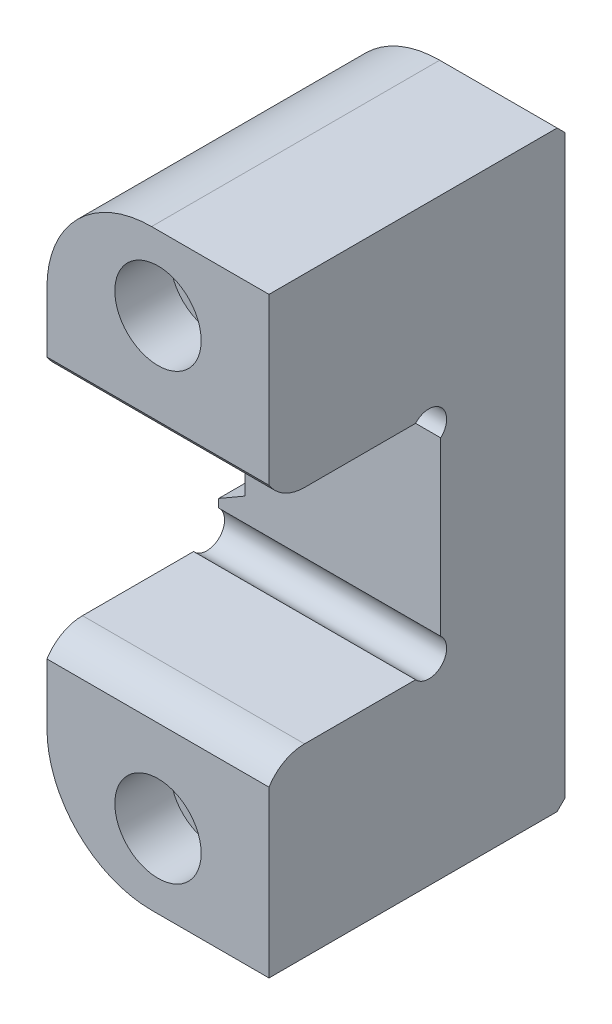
SolidWorks part; units mm, degrees
ref_plane "Front Plane" through (0, 0, 0) normal (0, 0, 1) x (1, 0, 0)
ref_plane "Top Plane" through (0, 0, 0) normal (0, 1, 0) x (1, 0, 0)
ref_plane "Right Plane" through (0, 0, 0) normal (1, 0, 0) x (0, 0, -1)
sketch "Sketch1" plane through (0, 0, 0) normal (1, 0, 0) x (0, 0, -1)
  line L0 (0, 0) -> (50000, 0) construction
  line L1 (0, 14.2875) -> (22.098, 14.2875)
  line L2 (0, 38.1) -> (38.1, 38.1)
  line L3 (0, 38.1) -> (0, 14.2875)
  line L4 (0, -38.1) -> (38.1, -38.1)
  line L5 (38.1, 38.1) -> (38.1, -38.1)
  line L6 (22.098, 14.2875) -> (22.098, -14.2875)
  line L7 (22.098, -14.2875) -> (0, -14.2875)
  line L9 (0, 15.7163) -> (0, -15.7163) construction
  line L10 (0, -14.2875) -> (0, -38.1)
  dimension "D1" = 38.1
  dimension "D2" = 76.2
  dimension "D3" = 22.098
  dimension "D4" = 28.575
extrude "Extrude1" add sketch "Sketch1" along normal mid plane 28.575
fillet "Fillet1" radius 13.462 2 edges at (-14.2875, -38.1, -19.05) (-14.2875, 38.1, -19.05)
sketch "Sketch2" plane through (-23.8125, 0, -38.1) normal (0, 0, 1) x (1, 0, 0)
  line L0 (0, 0) -> (50000, 0) construction
  line L1 (38.1, -38.1) -> (38.1, 38.1) construction
  line L2 (35.7187, 8.6085) -> (38.8937, 10.4415) construction
  line L3 (35.7187, 8.6085) -> (35.7187, -8.6085) construction
  line L4 (35.7187, -8.6085) -> (38.8937, -10.4415) construction
  line L5 (38.8937, 10.4415) -> (38.8937, -10.4415) construction
  line L6 (23.8125, 0) -> (23.8125, 50000) construction
  line L7 (8.7312, 10.4415) -> (8.7312, -10.4415)
  line L8 (11.9062, -8.6085) -> (8.7312, -10.4415)
  line L9 (11.9062, 8.6085) -> (11.9062, -8.6085)
  line L10 (11.9062, 8.6085) -> (8.7312, 10.4415)
  point P4 (37.3062, 9.525)
  point P10 (37.3062, -9.525)
  point P13 (10.3187, -9.525)
  point P14 (10.3187, 9.525)
  dimension "D1" = 19.05
  dimension "D2" = 2.3813
  dimension "D3" = 30
  dimension "D4" = 3.175
extrude "Cut-Extrude1" cut sketch "Sketch2" along normal through all
sketch "Sketch5" plane through (14.2875, 0, 0) normal (1, 0, 0) x (0, 0, -1)
  line L0 (0, 0) -> (50000, 0) construction
  line L1 (0, 14.2875) -> (22.098, 14.2875) construction
  line L2 (0, 38.1) -> (0, 14.2875) construction
  line L3 (0, -14.2875) -> (0, -38.1) construction
  line L4 (-1.778, -13.6525) -> (4.572, -13.6525)
  line L5 (-1.778, -13.6525) -> (-1.778, -16.8275)
  line L6 (-1.778, -16.8275) -> (0, -16.8275)
  line L7 (4.572, -13.6525) -> (4.572, -14.2875)
  line L8 (22.098, -14.2875) -> (0, -14.2875) construction
  line L9 (4.572, 13.6525) -> (4.572, 14.2875)
  line L10 (-1.778, 16.8275) -> (0, 16.8275)
  line L11 (-1.778, 13.6525) -> (-1.778, 16.8275)
  line L12 (-1.778, 13.6525) -> (4.572, 13.6525)
  arc A0 (1.7842, -14.5973) -> (4.572, -14.2875) centre (4.572, -26.9875) cw construction
  arc A1 (0, -16.8275) -> (1.7842, -14.5973) centre (2.286, -16.8275) cw construction
  arc A2 (0, 16.8275) -> (1.7842, 14.5973) centre (2.286, 16.8275) ccw construction
  arc A3 (1.7842, 14.5973) -> (4.572, 14.2875) centre (4.572, 26.9875) ccw construction
  arc A4 (0, 16.8275) -> (4.572, 14.2875) centre (4.572, 19.6723) ccw
  arc A5 (0, -16.8275) -> (4.572, -14.2875) centre (4.572, -19.6723) cw
  dimension "D1" = 2.286
  dimension "D2" = 12.7
  dimension "D3" = 3.175
  dimension "D4" = 6.35
  dimension "D5" = 4.572
extrude "Cut-Extrude2" cut sketch "Sketch5" against normal through all
sketch "Sketch6" plane through (14.2875, 0, 0) normal (1, 0, 0) x (0, 0, -1)
  line L0 (0, 0) -> (50000, 0) construction
  line L3 (22.098, 14.2875) -> (22.098, -14.2875) construction
  line L4 (4.572, 14.2875) -> (22.098, 14.2875) construction
  circle A0 centre (20.574, 12.7635) radius 2.286
  circle A1 centre (20.574, -12.7635) radius 2.286
  dimension "D2" = 0.762
  dimension "D3" = 2.286
  dimension "D1" = 0.762
extrude "Cut-Extrude3" cut sketch "Sketch6" against normal through all
hole_wizard "1/4\"-20 CBORE" positions "Sketch4" profile "Sketch3" counterbore size "1/4" standard "Ansi Inch"
sketch "Sketch4" plane through (0, 0, 0) normal (0, 0, 1) x (1, 0, 0)
  line L0 (0, 0) -> (0, 50000) construction
  line L1 (0, 0) -> (50000, 0) construction
  point P0 (0, 28.575)
  point P12 (0, -28.575)
  dimension "D1" = 57.15
sketch "Sketch3" plane through (0, 28.575, 0) normal (1, 0, 0) x (0, -1, 0)
  line L0 (0, 0) -> (0, 38.1)
  line L1 (0, 38.1) -> (3.5712, 38.1)
  line L3 (3.5712, 38.1) -> (3.5712, 7.1437)
  line L4 (3.5712, 7.1437) -> (5.5562, 7.1437)
  line L5 (5.5562, 7.1437) -> (5.5562, 0)
  line L7 (5.5562, 0) -> (0, 0)
  line L11 (0, -6.35) -> (0, 107.95) construction
  dimension "Thru Hole Dia." = 7.1425
  dimension "Thru Hole Depth" = 38.1
  dimension "C'Bore Dia." = 11.1125
  dimension "C'Bore Depth" = 7.1437
chamfer "Chamfer3" distance 3.81 angle 15 1 edges at (-11.9062, 0, -22.098)
chamfer "Chamfer1" distance 1.016 angle 45 6 edges at (-14.2875, -17.3106, -38.1) (-10.3446, -34.1571, -38.1) (6.731, -38.1, -38.1) (6.731, 38.1, -38.1) (-14.2875, 17.3106, -38.1) (-10.3446, 34.1571, -38.1)
